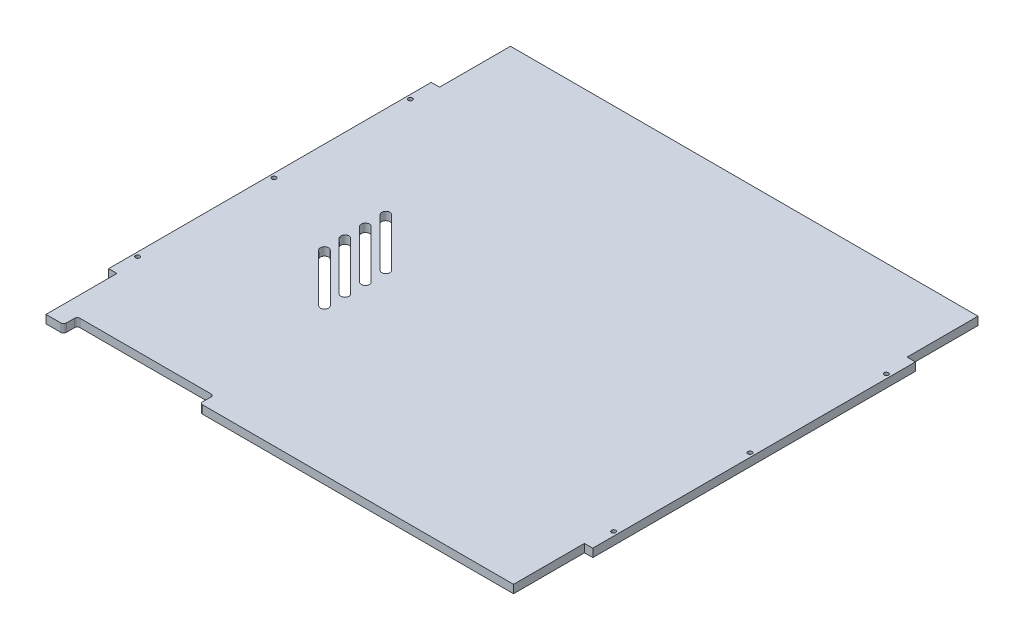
SolidWorks part; units mm, degrees
ref_plane "Спереди" through (0, 0, 0) normal (0, 0, 1) x (1, 0, 0)
ref_plane "Сверху" through (0, 0, 0) normal (0, 1, 0) x (1, 0, 0)
ref_plane "Справа" through (0, 0, 0) normal (1, 0, 0) x (0, 0, -1)
sketch "Эскиз1" plane through (0, 0, 0) normal (0, 1, 0) x (1, 0, 0)
  line L0 (0, 320.15) -> (0, 0) construction
  line L1 (0, 0) -> (371.6108, 0) construction
  line L3 (-177.475, 170.25) -> (177.475, 170.25)
  line L4 (-177.475, 170.25) -> (-177.475, -170.25)
  line L5 (-177.475, -170.25) -> (177.475, -170.25)
  line L6 (177.475, 170.25) -> (177.475, -170.25)
  point P8 (0, 170.25)
  point P9 (177.475, 0)
  dimension "D1" = 354.95
  dimension "D2" = 340.5
extrude "Бобышка-Вытянуть1" add sketch "Эскиз1" along normal blind 6
sketch "Эскиз2" plane through (0, 6, 0) normal (0, 1, 0) x (1, 0, 0)
  line L0 (-177.475, -170.25) -> (177.475, -170.25) construction
  line L1 (-177.475, 170.25) -> (-177.475, -170.25) construction
  line L2 (-158.475, -170.25) -> (-58.475, -170.25)
  line L3 (-158.475, -170.25) -> (-158.475, -160.25)
  line L4 (-158.475, -160.25) -> (-58.475, -160.25)
  line L6 (-58.475, -170.25) -> (-58.475, -160.25)
  dimension "D1" = 10
  dimension "D2" = 100
  dimension "D3" = 19
extrude "Вырез-Вытянуть1" cut sketch "Эскиз2" against normal through all
sketch "Эскиз3" plane through (0, 6, 0) normal (0, 1, 0) x (1, 0, 0)
  line L0 (0, 206.7145) -> (0, 0) construction
  line L1 (0, 0) -> (258.4368, 0) construction
  line L2 (171.375, 170.25) -> (171.375, 118.25)
  line L3 (177.475, -170.25) -> (171.375, -170.25)
  line L4 (177.475, -170.25) -> (177.475, -118.25)
  line L5 (177.475, -118.25) -> (171.375, -118.25)
  line L6 (171.375, -170.25) -> (171.375, -118.25)
  line L7 (177.475, 118.25) -> (171.375, 118.25)
  line L8 (177.475, 170.25) -> (177.475, 118.25)
  line L9 (177.475, 170.25) -> (171.375, 170.25)
  line L10 (-177.475, 170.25) -> (-171.375, 170.25)
  line L11 (-177.475, 170.25) -> (-177.475, 118.25)
  line L12 (-177.475, 118.25) -> (-171.375, 118.25)
  line L13 (-171.375, 170.25) -> (-171.375, 118.25)
  line L14 (-171.375, -170.25) -> (-171.375, -118.25)
  line L15 (-177.475, -118.25) -> (-171.375, -118.25)
  line L16 (-177.475, -170.25) -> (-177.475, -118.25)
  line L17 (-177.475, -170.25) -> (-171.375, -170.25)
  dimension "D1" = 236.5
  dimension "D2" = 6.1
extrude "Вырез-Вытянуть2" cut sketch "Эскиз3" against normal through all
sketch "Эскиз4" plane through (0, 6, 0) normal (0, 1, 0) x (1, 0, 0)
  line L0 (-110.1527, 17.6777) -> (-74.7973, -17.6777) construction
  line L1 (-108.0313, 19.799) -> (-72.676, -15.5563)
  line L2 (-112.274, 15.5563) -> (-76.9187, -19.799)
  line L3 (0, 198.2801) -> (0, 0) construction
  line L4 (0, 0) -> (213.9615, 0) construction
  line L5 (-177.475, 118.25) -> (-177.475, -118.25) construction
  line L6 (-110.1527, 2.6777) -> (-74.7973, -32.6777) construction
  line L7 (-108.0313, 4.799) -> (-72.676, -30.5563)
  line L8 (-112.274, 0.5563) -> (-76.9187, -34.799)
  line L9 (-110.1527, -12.3223) -> (-74.7973, -47.6777) construction
  line L10 (-108.0313, -10.201) -> (-72.676, -45.5563)
  line L11 (-112.274, -14.4437) -> (-76.9187, -49.799)
  line L12 (-110.1527, -27.3223) -> (-74.7973, -62.6777) construction
  line L13 (-108.0313, -25.201) -> (-72.676, -60.5563)
  line L14 (-112.274, -29.4437) -> (-76.9187, -64.799)
  arc A0 (-108.0313, 19.799) -> (-112.274, 15.5563) centre (-110.1527, 17.6777) ccw
  arc A1 (-76.9187, -19.799) -> (-72.676, -15.5563) centre (-74.7973, -17.6777) ccw
  arc A2 (-108.0313, 4.799) -> (-112.274, 0.5563) centre (-110.1527, 2.6777) ccw
  arc A3 (-76.9187, -34.799) -> (-72.676, -30.5563) centre (-74.7973, -32.6777) ccw
  arc A4 (-108.0313, -10.201) -> (-112.274, -14.4437) centre (-110.1527, -12.3223) ccw
  arc A5 (-76.9187, -49.799) -> (-72.676, -45.5563) centre (-74.7973, -47.6777) ccw
  arc A6 (-108.0313, -25.201) -> (-112.274, -29.4437) centre (-110.1527, -27.3223) ccw
  arc A7 (-76.9187, -64.799) -> (-72.676, -60.5563) centre (-74.7973, -62.6777) ccw
  point P2 (-92.475, 0)
  point P16 (-92.475, -15)
  point P23 (-92.475, -30)
  point P30 (-92.475, -45)
  dimension "D1" = 3
  dimension "D2" = 50
  dimension "D3" = 85
  dimension "D4" = 45
  dimension "D6" = 15
  dimension "D5" = 4
extrude "Вырез-Вытянуть3" cut sketch "Эскиз4" against normal through all
fillet "Скругление1" radius 2 4 edges at (-58.475, 3, 170.25) (-158.475, 3, 170.25) (-158.475, 3, 160.25) (-58.475, 3, 160.25)
sketch "Эскиз5" plane through (0, 6, 0) normal (0, 1, 0) x (1, 0, 0)
  line L0 (0, 178.2569) -> (0, 0) construction
  line L1 (0, 0) -> (219.1867, 0) construction
  line L2 (174.475, 100) -> (174.475, 0) construction
  line L3 (177.475, -118.25) -> (177.475, 118.25) construction
  circle A0 centre (174.475, 100) radius 1.55
  circle A1 centre (174.475, 0) radius 1.55
  circle A2 centre (174.475, -100) radius 1.55
  circle A3 centre (-174.475, 0) radius 1.55
  circle A4 centre (-174.475, 100) radius 1.55
  circle A5 centre (-174.475, -100) radius 1.55
  dimension "D1" = 3.1
  dimension "D3" = 200
  dimension "D2" = 3
extrude "Вырез-Вытянуть4" cut sketch "Эскиз5" against normal through all
